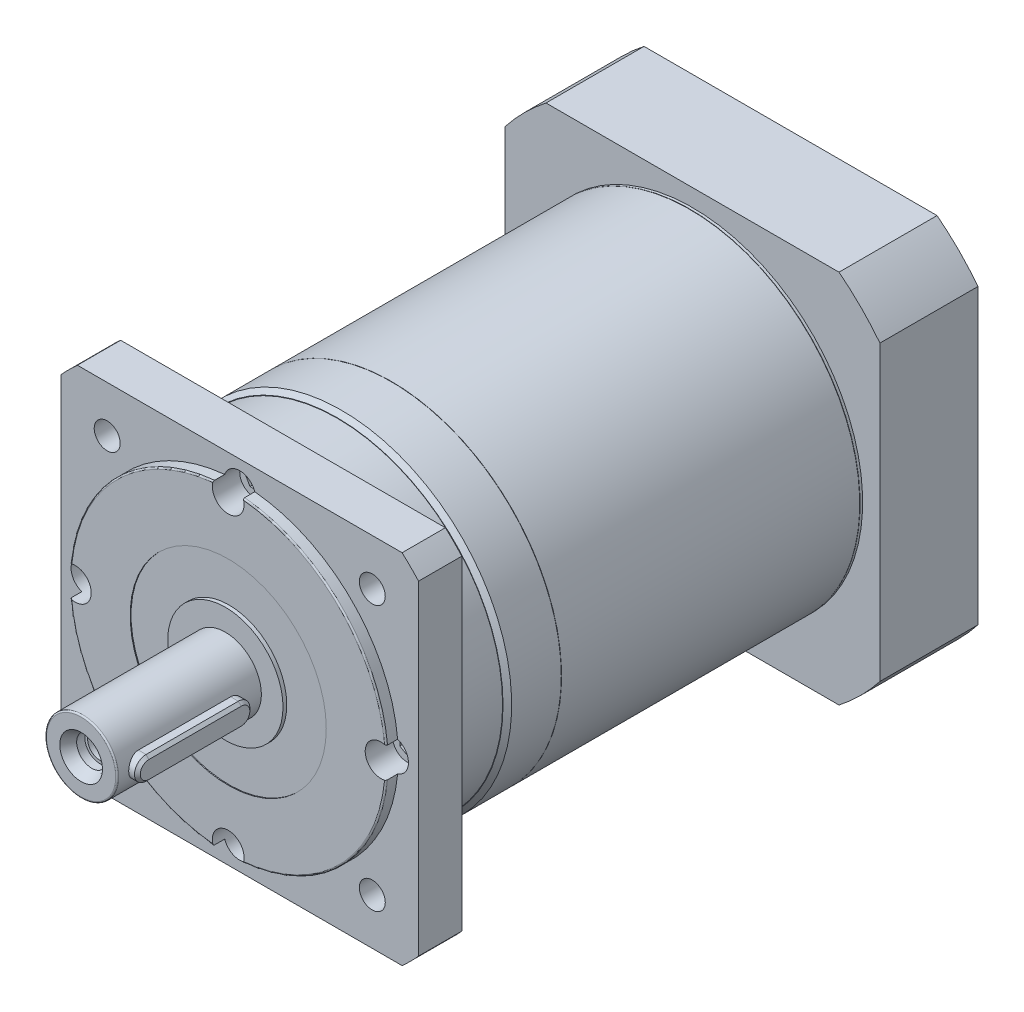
SolidWorks part; units mm, degrees
ref_plane "前视基准面" through (0, 0, 0) normal (0, 0, 1) x (1, 0, 0)
ref_plane "上视基准面" through (0, 0, 0) normal (0, 1, 0) x (1, 0, 0)
ref_plane "右视基准面" through (0, 0, 0) normal (1, 0, 0) x (0, 0, -1)
sketch "草图1" plane through (0, 0, 0) normal (0, 0, 1) x (1, 0, 0)
  circle A0 centre (0, 0) radius 59
extrude "凸台-拉伸1" add sketch "草图1" along normal blind 56.5
sketch "草图2" plane through (0, 0, 56.5) normal (0, 0, 1) x (1, 0, 0)
  circle A0 centre (0, 0) radius 55
extrude "切除-拉伸1" cut sketch "草图2" against normal blind 4 flip side to cut
ref_plane "基准面1" through (0, 0, -0.1) normal (0, 0, -1) x (-1, 0, 0)
sketch "草图4" plane through (0, 0, -0.1) normal (0, 0, -1) x (-1, 0, 0)
  circle A0 centre (0, 0) radius 59
extrude "凸台-拉伸2" add sketch "草图4" along normal blind 103.4 separate body
ref_plane "基准面2" through (0, 0, -103.6) normal (0, 0, -1) x (-1, 0, 0)
sketch "草图5" plane through (0, 0, -103.6) normal (0, 0, -1) x (-1, 0, 0)
  circle A0 centre (0, 0) radius 59
extrude "凸台-拉伸3" add sketch "草图5" along normal blind 0.9 separate body
sketch "草图6" plane through (0, 0, -104.5) normal (0, 0, -1) x (-1, 0, 0)
  line L1 (-50.806, 65) -> (50.806, 65)
  line L2 (-65, 50.806) -> (-65, -50.806)
  line L3 (-50.806, -65) -> (50.806, -65)
  line L4 (65, 50.806) -> (65, -50.806)
  arc A0 (-50.806, 65) -> (-65, 50.806) centre (0, 0) ccw
  arc A1 (-65, -50.806) -> (-50.806, -65) centre (0, 0) ccw
  arc A2 (50.806, -65) -> (65, -50.806) centre (0, 0) ccw
  arc A3 (65, 50.806) -> (50.806, 65) centre (0, 0) ccw
  dimension "D1" = 65
  dimension "D3" = 65
extrude "凸台-拉伸4" add sketch "草图6" along normal blind 34
sketch "草图7" plane through (0, 0, -138.5) normal (0, 0, -1) x (-1, 0, 0)
  circle A0 centre (0, 0) radius 55
extrude "切除-拉伸3" cut sketch "草图7" against normal blind 8
sketch "草图8" plane through (0, 0, -130.5) normal (0, 0, -1) x (-1, 0, 0)
  circle A0 centre (0, 0) radius 39
extrude "切除-拉伸4" cut sketch "草图8" against normal blind 30
sketch "草图9" plane through (0, 0, -138.5) normal (0, 0, -1) x (-1, 0, 0)
  line L0 (0, 0) -> (-53.5, 0) construction
  circle A0 centre (0, 0) radius 53.5 construction
  circle A1 centre (-53.5, 0) radius 5.5
extrude "切除-拉伸5" cut sketch "草图9" against normal blind 18
pattern_circular "阵列(圆周)1" count 6 over 360 about axis through (0, 0, 0) along (0, 0, 1) of "切除-拉伸5"
sketch "草图10" plane through (0, 0, -138.5) normal (0, 0, -1) x (-1, 0, 0)
  line L0 (0, 0) -> (-51.2652, 51.2652)
  circle A0 centre (0, 0) radius 72.5
hole_wizard "M8 螺纹孔1" positions "3D草图1" profile "草图11" tap size "M8" standard "GB"
sketch3d "3D草图1"
  point P0 (51.2652, 51.2652, -138.5)
sketch "草图11" plane through (51.2652, 51.2652, -138.5) normal (1, 0, 0) x (0, 1, 0)
  line L0 (0, 0) -> (0, 32.0429)
  line L1 (0, 32.0429) -> (3.4, 30)
  line L2 (3.4, 30) -> (3.4, 0)
  line L5 (3.4, 0) -> (0, 0)
  line L10 (0, 32.0429) -> (-3.4, 30) construction
  line L11 (0, -6.35) -> (0, 107.95) construction
  dimension "螺纹孔钻头直径" = 6.8
  dimension "螺纹孔钻头深度" = 30
  dimension "导头角度" = 118
pattern_circular "阵列(圆周)2" count 4 over 360 about axis through (0, 0, 0) along (0, 0, 1) of "M8 螺纹孔1"
fillet "圆角1" radius 0.5 1 edges at (55, 0, 56.5)
sketch "草图12" plane through (0, 0, 56.5) normal (0, 0, 1) x (1, 0, 0)
  circle A0 centre (0, 0) radius 20
extrude "凸台-拉伸5" add sketch "草图12" along normal blind 1
sketch "草图13" plane through (0, 0, 57.5) normal (0, 0, 1) x (1, 0, 0)
  circle A0 centre (0, 0) radius 12.5
extrude "凸台-拉伸6" add sketch "草图13" along normal blind 50
fillet "圆角2" radius 0.5 1 edges at (12.5, 0, 107.5)
sketch "草图14" plane through (0, 0, 52.5) normal (0, 0, 1) x (1, 0, 0)
  line L0 (0, 0) -> (0, -53) construction
  circle A0 centre (0, 0) radius 53 construction
  circle A1 centre (0, -53) radius 5.5
extrude "切除-拉伸6" cut sketch "草图14" against normal blind 11
pattern_circular "阵列(圆周)3" count 4 over 360 about axis through (0, 0, 0) along (0, 0, 1) of "切除-拉伸6"
sketch "草图15" plane through (0, 0, 41.5) normal (0, 0, 1) x (1, 0, 0)
  line L1 (1.4595, -50.5094) -> (-1.4271, -50.4907)
  line L2 (-1.4271, -50.4907) -> (-2.8867, -52.9813)
  line L3 (-2.8867, -52.9813) -> (-1.4595, -55.4906)
  line L4 (-1.4595, -55.4906) -> (1.4271, -55.5093)
  line L5 (1.4271, -55.5093) -> (2.8867, -53.0187)
  line L6 (2.8867, -53.0187) -> (1.4595, -50.5094)
  circle A0 centre (0, -53) radius 5
  circle A1 centre (0, -53) radius 2.5 construction
  dimension "D1" = 5
extrude "凸台-拉伸7" add sketch "草图15" along normal blind 6
pattern_circular "阵列(圆周)4" count 4 over 360 about axis through (0, 0, 0) along (0, 0, 1) of "凸台-拉伸7"
sketch "草图16" plane through (0, 0, -120.5) normal (0, 0, -1) x (-1, 0, 0)
  line L1 (-51.8653, 2.3793) -> (-54.7432, 2.6053)
  line L2 (-54.7432, 2.6053) -> (-56.3779, 0.226)
  line L3 (-56.3779, 0.226) -> (-55.1347, -2.3793)
  line L4 (-55.1347, -2.3793) -> (-52.2568, -2.6053)
  line L5 (-52.2568, -2.6053) -> (-50.6221, -0.226)
  line L6 (-50.6221, -0.226) -> (-51.8653, 2.3793)
  circle A0 centre (-53.5, 0) radius 5
  circle A1 centre (-53.5, 0) radius 2.5 construction
  dimension "D1" = 5
extrude "凸台-拉伸8" add sketch "草图16" along normal blind 6
pattern_circular "阵列(圆周)5" count 6 over 360 about axis through (0, 0, 0) along (0, 0, 1) of "凸台-拉伸8"
ref_plane "基准面3" through (0, 0, -123.5) normal (0, 0, -1) x (-1, 0, 0)
sketch "草图17" plane through (0, 0, -123.5) normal (0, 0, -1) x (-1, 0, 0)
  circle A0 centre (0, 0) radius 32.5
extrude "凸台-拉伸9" add sketch "草图17" against normal up to surface (23 mm away)
chamfer "倒角2" distance 1 angle 45 1 edges at (-32.5, 0, -123.5)
sketch "草图18" plane through (0, 0, -123.5) normal (0, 0, -1) x (-1, 0, 0)
  line L1 (-35.6857, 0.5) -> (35.4718, 0.5)
  line L2 (-35.6857, 0.5) -> (-35.6857, -0.5)
  line L3 (-35.6857, -0.5) -> (35.4718, -0.5)
  line L4 (35.4718, 0.5) -> (35.4718, -0.5)
  dimension "D1" = 0.5
  dimension "D2" = 1
extrude "切除-拉伸7" cut sketch "草图18" against normal up to surface (23 mm away)
sketch "草图19" plane through (0, 0, -138.5) normal (0, 0, -1) x (-1, 0, 0)
  circle A0 centre (0, 0) radius 11
extrude "切除-拉伸8" cut sketch "草图19" against normal blind 59
sketch "草图20" plane through (0, 0, 52.5) normal (0, 0, 1) x (1, 0, 0)
  line L0 (0, 0) -> (-35.3553, 35.3553)
  line L1 (0, 0) -> (0, 53)
  circle A0 centre (0, 0) radius 50
  dimension "D1" = 45
sketch "草图22" plane through (0, 0, 0) normal (1, 0, 0) x (0, 0, -1)
  line L0 (-107.5, 12) -> (-107.5, -12) construction
  line L1 (-99.5, 4) -> (-67.5, 4)
  line L2 (-99.5, -4) -> (-67.5, -4)
  arc A0 (-99.5, 4) -> (-99.5, -4) centre (-99.5, 0) ccw
  arc A1 (-67.5, -4) -> (-67.5, 4) centre (-67.5, 0) ccw
  dimension "D1" = 8
  dimension "D2" = 32
extrude "凸台-拉伸10" add sketch "草图22" along normal blind 15.5
chamfer "倒角3" distance 1 angle 45 4 edges at (15.5, 4, 83.5) (15.5, 0, 103.5) (15.5, 0, 63.5) (15.5, -4, 83.5)
sketch "草图23" plane through (0, 0, 52.5) normal (0, 0, 1) x (1, 0, 0)
  line L1 (-56.3033, 62) -> (56.3033, 62)
  line L2 (-62, 56.3033) -> (-62, -56.3033)
  line L3 (-56.3033, -62) -> (56.3033, -62)
  line L4 (62, 56.3033) -> (62, -56.3033)
  circle A0 centre (0, 0) radius 59
  arc A1 (-56.3033, 62) -> (-62, 56.3033) centre (0, 0) ccw
  arc A2 (-62, -56.3033) -> (-56.3033, -62) centre (0, 0) ccw
  arc A3 (56.3033, -62) -> (62, -56.3033) centre (0, 0) ccw
  arc A4 (62, 56.3033) -> (56.3033, 62) centre (0, 0) ccw
  dimension "D2" = 118
  dimension "D1" = 62
  dimension "D3" = 62
extrude "凸台-拉伸11" add sketch "草图23" against normal blind 15
sketch "草图24" plane through (0, 0, 37.5) normal (0, 0, -1) x (-1, 0, 0)
  circle A0 centre (0, 0) radius 57.35
extrude "切除-拉伸9" cut sketch "草图24" along normal blind 18.8 flip side to cut
chamfer "倒角4" distance 1.5 angle 45 1 edges at (-59, 0, 18.7)
sketch "草图25" plane through (0, 0, 52.5) normal (0, 0, 1) x (1, 0, 0)
  line L0 (0, 0) -> (-59.2202, 59.2202) construction
  circle A0 centre (0, 0) radius 65 construction
  arc A1 (-56.3033, 62) -> (-62, 56.3033) centre (0, 0) ccw construction
  circle A2 centre (-45.9619, 45.9619) radius 4.5
extrude "切除-拉伸10" cut sketch "草图25" against normal blind 18.8
pattern_circular "阵列(圆周)6" count 4 over 360 about axis through (0, 0, 0) along (0, 0, 1) of "切除-拉伸10"
sketch "草图27" plane through (0, 0, 56.5) normal (0, 0, 1) x (1, 0, 0)
  circle A0 centre (-53, 0) radius 5.5
extrude "切除-拉伸11" cut sketch "草图27" against normal up to surface (4 mm away)
pattern_circular "阵列(圆周)7" count 4 over 360 about axis through (0, 0, 52.5) along (0, 0, 1) of "切除-拉伸11"
sketch "草图28" plane through (0, 0, 56.5) normal (0, 0, 1) x (1, 0, 0)
  circle A0 centre (0, 0) radius 34
  circle A1 centre (0, 0) radius 20
extrude "切除-拉伸12" cut sketch "草图28" against normal blind 0.3
sketch "草图29" plane through (0, 0, 107.5) normal (0, 0, 1) x (1, 0, 0)
  circle A0 centre (0, 0) radius 5.25
extrude "切除-拉伸13" cut sketch "草图29" against normal blind 6.5
ref_plane "基准面4" through (0, 0, 103.8) normal (0, 0, 1) x (1, 0, 0)
sketch "草图30" plane through (0, 0, 103.8) normal (0, 0, 1) x (1, 0, 0)
  circle A0 centre (0, 0) radius 5.25 construction
  circle A1 centre (0, 0) radius 5.25
sketch "草图31" plane through (0, 0, 107.5) normal (0, 0, 1) x (1, 0, 0)
  circle A0 centre (0, 0) radius 7.4
loft "切除-放样1" cut profiles "草图31", "草图30"
hole_wizard "M10 螺纹孔1" positions "3D草图2" profile "草图32" tap size "M10" standard "GB"
sketch3d "3D草图2"
  line L0 (0, 0, 101) -> (0, 0, 103.8) construction
  point P0 (0, 0, 101)
sketch "草图32" plane through (0, 0, 101) normal (1, 0, 0) x (0, -1, 0)
  line L0 (0, 0) -> (0, 26.5537)
  line L1 (0, 26.5537) -> (4.25, 24)
  line L2 (4.25, 24) -> (4.25, 0)
  line L5 (4.25, 0) -> (0, 0)
  line L10 (0, 26.5537) -> (-4.25, 24) construction
  line L11 (0, -6.35) -> (0, 107.95) construction
  dimension "螺纹孔钻头直径" = 8.5
  dimension "螺纹孔钻头深度" = 24
  dimension "导头角度" = 118
